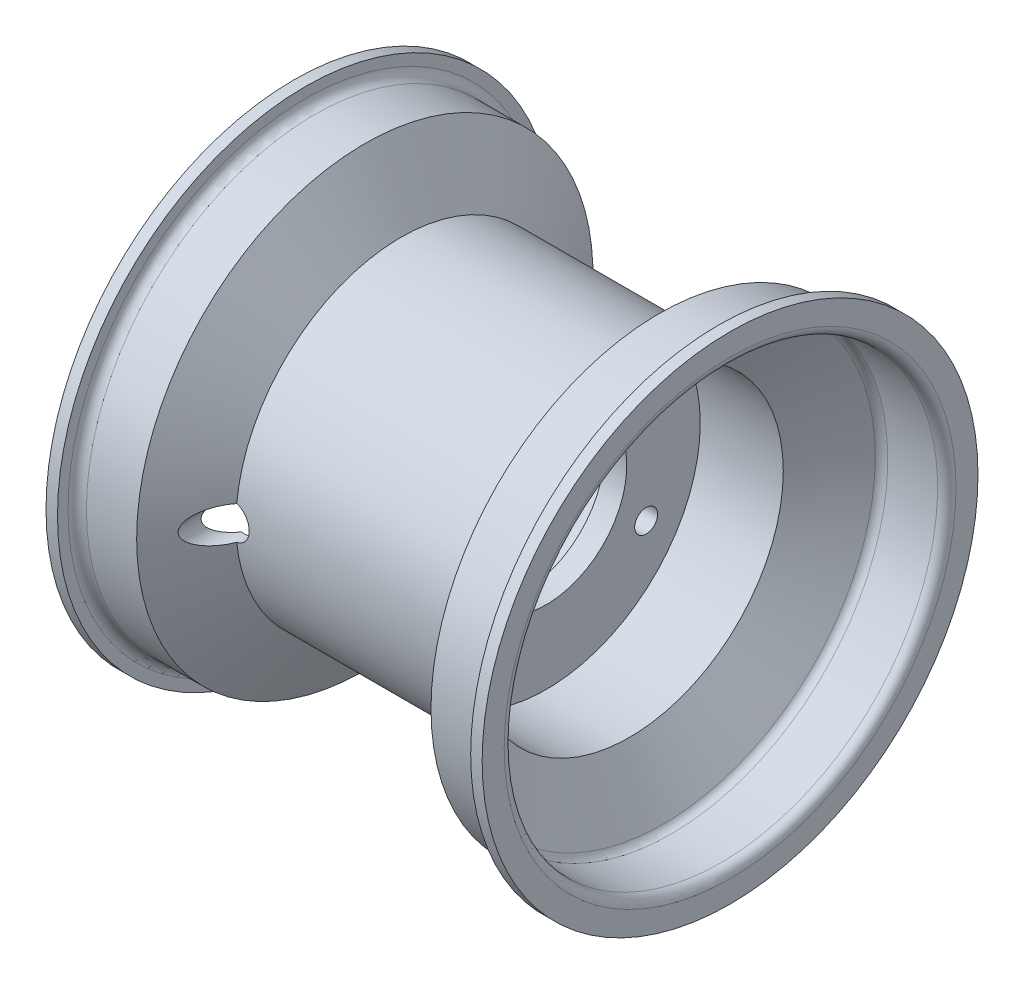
SolidWorks part; units mm, degrees
ref_plane "Front Plane" through (0, 0, 0) normal (0, 0, 1) x (1, 0, 0)
ref_plane "Top Plane" through (0, 0, 0) normal (0, 1, 0) x (1, 0, 0)
ref_plane "Right Plane" through (0, 0, 0) normal (1, 0, 0) x (0, 0, -1)
sketch "Sketch1" plane through (0, 0, 0) normal (0, 0, 1) x (1, 0, 0)
  line L0 (0, 0) -> (168.379, 0) construction
  line L1 (-60.325, 68.58) -> (-57.15, 68.58)
  line L2 (-57.15, 68.58) -> (-57.15, 65.659)
  line L3 (-54.61, 63.119) -> (-40.7119, 63.119)
  line L4 (-40.7119, 63.119) -> (-30.6666, 45.72)
  line L5 (-30.6666, 45.72) -> (30.6666, 45.72)
  line L6 (30.6666, 45.72) -> (40.7119, 63.119)
  line L7 (40.7119, 63.119) -> (54.61, 63.119)
  line L8 (57.15, 65.659) -> (57.15, 68.58)
  line L9 (57.15, 68.58) -> (60.325, 68.58)
  line L10 (60.325, 68.58) -> (60.325, 62.484)
  line L11 (57.785, 59.944) -> (44.0115, 59.944)
  line L12 (41.8118, 58.674) -> (32.4997, 42.545)
  line L13 (9.525, 42.545) -> (9.525, 22.225)
  line L14 (9.525, 22.225) -> (3.302, 22.225)
  line L15 (-32.4997, 42.545) -> (3.302, 42.545)
  line L16 (-32.4997, 42.545) -> (-41.8118, 58.674)
  line L17 (-44.0115, 59.944) -> (-57.785, 59.944)
  line L18 (-60.325, 62.484) -> (-60.325, 68.58)
  line L19 (32.4997, 42.545) -> (9.525, 42.545)
  line L20 (0, 0) -> (0, -49.5339) construction
  line L21 (3.302, 22.225) -> (3.302, 42.545)
  arc A3 (44.0115, 59.944) -> (41.8118, 58.674) centre (44.0115, 57.404) ccw
  arc A4 (60.325, 62.484) -> (57.785, 59.944) centre (57.785, 62.484) cw
  arc A5 (54.61, 63.119) -> (57.15, 65.659) centre (54.61, 65.659) ccw
  arc A6 (-41.8118, 58.674) -> (-44.0115, 59.944) centre (-44.0115, 57.404) ccw
  arc A7 (-57.15, 65.659) -> (-54.61, 63.119) centre (-54.61, 65.659) ccw
  arc A8 (-57.785, 59.944) -> (-60.325, 62.484) centre (-57.785, 62.484) cw
  point P30 (42.545, 59.944)
  point P33 (60.325, 59.944)
  point P38 (-42.545, 59.944)
  point P43 (-60.325, 59.944)
  dimension "D16" = 2.54
  dimension "D1" = 44.45
  dimension "D2" = 3.175
  dimension "D3" = 119.888
  dimension "D4" = 137.16
  dimension "D5" = 3.175
  dimension "D6" = 3.175
  dimension "D7" = 63.627
  dimension "D8" = 17.78
  dimension "D9" = 120
  dimension "D10" = 91.44
  dimension "D11" = 3.175
  dimension "D12" = 120.65
  dimension "D13" = 3.175
  dimension "D14" = 3.175
  dimension "D15" = 50.8
  dimension "D17" = 17.78
  dimension "D19" = 114.3
  dimension "D20" = 6.223
revolve "Revolve1" add sketch "Sketch1" angle 360 about L0
sketch "Sketch2" plane through (0, 0, 0) normal (1, 0, 0) x (0, 0, -1)
  line L0 (0, 0) -> (0, 31.8516) construction
  line L1 (0, 0) -> (27.5843, -15.9258) construction
  line L2 (0, 0) -> (-27.5843, -15.9258) construction
  circle A0 centre (0, 31.8516) radius 3.175
  circle A1 centre (27.5843, -15.9258) radius 3.175
  circle A2 centre (-27.5843, -15.9258) radius 3.175
  dimension "D4" = 6.35
  dimension "D1" = 120
  dimension "D2" = 120
  dimension "D3" = 31.8516
  dimension "D5" = 55.1686
extrude "Cut-Extrude1" cut sketch "Sketch2" against normal mid plane 50.8
sketch "Sketch3" plane through (0, 0, 0) normal (0, 0, 1) x (1, 0, 0)
  circle A0 centre (-31.75, 0) radius 4.7625
  dimension "D2" = 9.525
  dimension "D1" = 31.75
extrude "Cut-Extrude2" cut sketch "Sketch3" along normal blind 71.12
